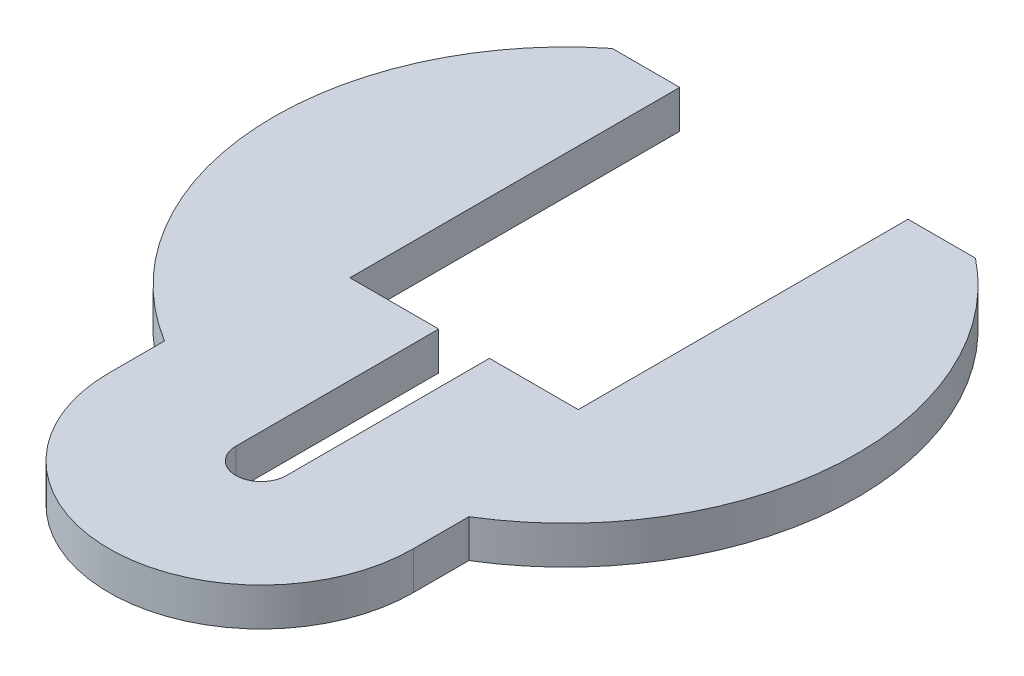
SolidWorks part; units mm, degrees
ref_plane "Front" through (0, 0, 0) normal (0, 0, 1) x (1, 0, 0)
ref_plane "Top" through (0, 0, 0) normal (0, 1, 0) x (1, 0, 0)
ref_plane "Right" through (0, 0, 0) normal (1, 0, 0) x (0, 0, -1)
sketch "Sketch1" plane through (0, 0, 0) normal (0, 1, 0) x (1, 0, 0)
  line L1 (-9, 16) -> (-9, 42)
  line L2 (2, 16) -> (9, 16)
  line L3 (9, 42) -> (14.3178, 42)
  line L5 (12, 0) -> (12, 4.3786)
  line L6 (-2, 0) -> (-2, 16)
  line L7 (2, 0) -> (2, 16)
  line L9 (9, 16) -> (9, 42)
  line L10 (-12, 0) -> (-12, 4.3786)
  line L11 (-9, 42) -> (-14.3178, 42)
  line L12 (-2, 16) -> (-9, 16)
  arc A0 (-12, 4.3786) -> (-14.3178, 42) centre (0, 24) cw
  arc A4 (-12, 0) -> (12, 0) centre (0, 0) ccw
  arc A5 (12, 4.3786) -> (14.3178, 42) centre (0, 24) ccw
  arc A6 (-2, 0) -> (2, 0) centre (0, 0) ccw
  dimension "D1" = 23
  dimension "D2" = 2
  dimension "D3" = 12
  dimension "D4" = 24
  dimension "D5" = 18
  dimension "D6" = 26
extrude "Extrude1" add sketch "Sketch1" along normal blind 3
